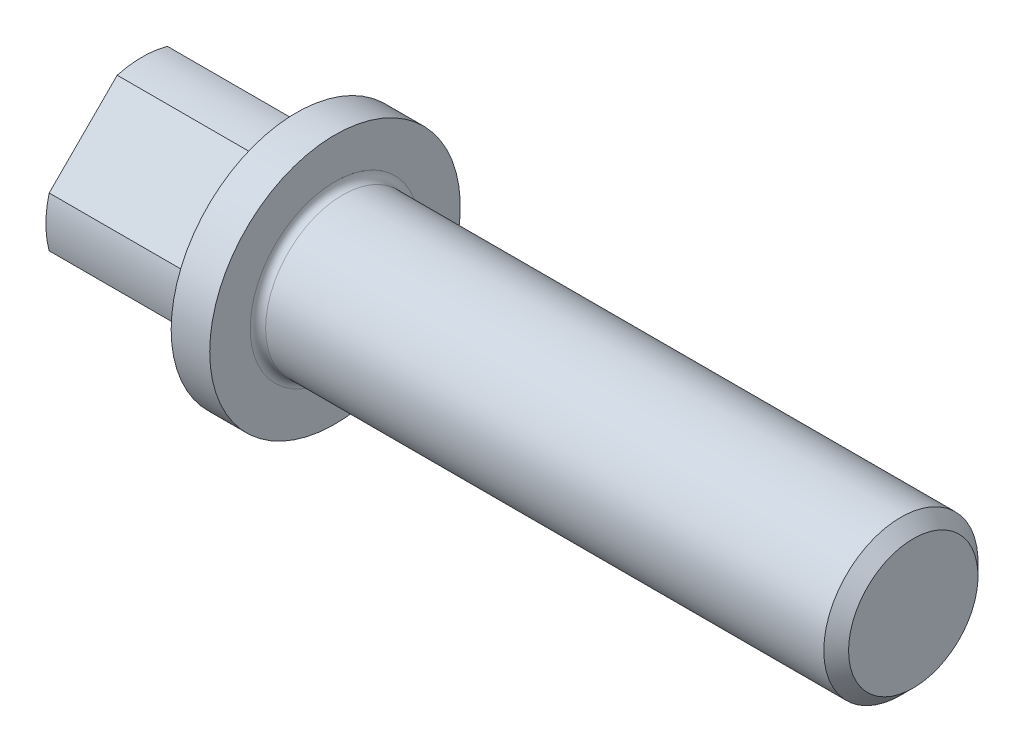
SolidWorks part; units mm, degrees
ref_plane "Plane1" through (0, 0, 0) normal (0, 0, 1) x (1, 0, 0)
ref_plane "Plane2" through (0, 0, 0) normal (0, 1, 0) x (1, 0, 0)
ref_plane "Plane3" through (0, 0, 0) normal (1, 0, 0) x (0, 0, -1)
sketch "BodySke" plane through (0, 0, 0) normal (0, 0, 1) x (1, 0, 0)
  line L0 (0, 0) -> (0, 9.75)
  line L1 (0, 9.75) -> (15, 9.75)
  line L2 (15, 9.75) -> (15, 6)
  line L3 (15, 6) -> (59.036, 6)
  line L4 (60, 5.036) -> (60, 0)
  line L5 (60, 0) -> (0, 0)
  line L6 (-31.75, 0) -> (127, 0) construction
  line L8 (60, 5.036) -> (59.036, 6)
  line L10 (60, -5.036) -> (59.036, -6) construction
  line L11 (16.75, 4.525) -> (16.75, -1.825) construction
  line L12 (15, 4.525) -> (15, -1.825) construction
  line L13 (0, 4.525) -> (0, -1.825) construction
  dimension "Diameter" = 12
  dimension "Head_ht" = 15
  dimension "Length" = 45
  dimension "Body_ch_ang" = 45
  dimension "Head_dia" = 19.5
  dimension "Minor_dia" = 10.072
  dimension "Advance" = 1.75
  dimension "Thread_nom" = 45
  dimension "Thread_length" = 60
revolve "Base-Revolve" add sketch "BodySke"
fillet "Fillet1" radius 0.6 1 edges at (15, 0, 6)
fillet "Fillet2" radius 0.6 1 edges at (0, 0, 9.75)
sketch "ThdSchSke" plane through (0, 0, 0) normal (0, 0, 1) x (1, 0, 0)
  line L0 (17.625, -5.036) -> (16.95, -6)
  line L1 (17.625, -5.036) -> (18.3, -6)
  line L2 (18.3, -6) -> (18.3, -7.5)
  line L3 (-3.175, 0) -> (5.1513, 0) construction
  line L4 (0, 9.15) -> (0, -9.15) construction
  line L5 (18.3, -7.5) -> (16.95, -7.5)
  line L6 (16.95, -7.5) -> (16.95, -6)
  dimension "Thread_minor" = 10.072
  dimension "Diameter" = 12
  dimension "Start" = 17.625
  dimension "SideAngle" = 55
  dimension "VeeAngle" = 70
  dimension "Overcut" = 15
revolve "ThreadSchematic" [suppressed] cut sketch "ThdSchSke" angle 360 about L3
pattern_linear "ThdSchPat" [suppressed]
sketch "SqrDrvSke" plane through (0, 0, 0) normal (1, 0, 0) x (0, 0, -1)
  line L0 (1.9504, -7.2419) -> (7.2419, -1.9504)
  line L1 (-1.9504, -7.2419) -> (-7.2419, -1.9504)
  line L2 (7.2419, 1.9504) -> (1.9504, 7.2419)
  line L3 (-7.2419, 1.9504) -> (-1.9504, 7.2419)
  line L4 (0, 9.525) -> (0, -9.525) construction
  line L5 (6.35, 0) -> (-7.0711, 0) construction
  arc A0 (1.9504, 7.2419) -> (-1.9504, 7.2419) centre (0, 0) ccw
  arc A1 (7.2419, -1.9504) -> (7.2419, 1.9504) centre (0, 0) ccw
  arc A2 (-1.9504, -7.2419) -> (1.9504, -7.2419) centre (0, 0) ccw
  arc A3 (-7.2419, 1.9504) -> (-7.2419, -1.9504) centre (0, 0) ccw
  dimension "DriveDia" = 15
  dimension "SquareWid" = 13
extrude "Square drive" cut sketch "SqrDrvSke" along normal blind 12 flip side to cut
equation "\"Thread_minor@ThreadCosmetic\"  =  \"Minor_dia@BodySke\""
equation "\"Thread_length@ThreadCosmetic\" = ((sgn( (\"Length@BodySke\" - \"Advance@BodySke\" * 1.5) - \"Thread_nom@BodySke\" )-1)*( (\"Length@BodySke\" - \"Advance@BodySke\" * 1.5) - \"Thread_nom@BodySke\" ))/-2+ \"Thread_no"
equation "\"Thread_minor@ThdSchSke\" = \"Minor_dia@BodySke\""
equation "\"Diameter@ThdSchSke\" = \"Diameter@BodySke\""
equation "\"Overcut@ThdSchSke\" = \"Diameter@BodySke\" * 1.25"
equation "\"Start@ThdSchSke\" = \"Head_ht@BodySke\" + \"Length@BodySke\" - \"Thread_length@ThreadCosmetic\"  '---Non-countersunk---"
equation "\"Num_threads@ThdSchPat\" = int( \"Thread_length@ThreadCosmetic\" / \"Advance@BodySke\" + 0.999 )  + 1"
equation "\"Advance@ThdSchPat\" = \"Thread_length@ThreadCosmetic\" /  (\"Num_threads@ThdSchPat\" - 1) 'relax it"
equation "\"Num_threads@ThdSchPat\" = \"Num_threads@ThdSchPat\" - sgn( \"Num_threads@ThdSchPat\" - 1) '---chamfered tips only---"
equation "\"DriveDia@SqrDrvSke\" = \"Head_ht@BodySke\""
